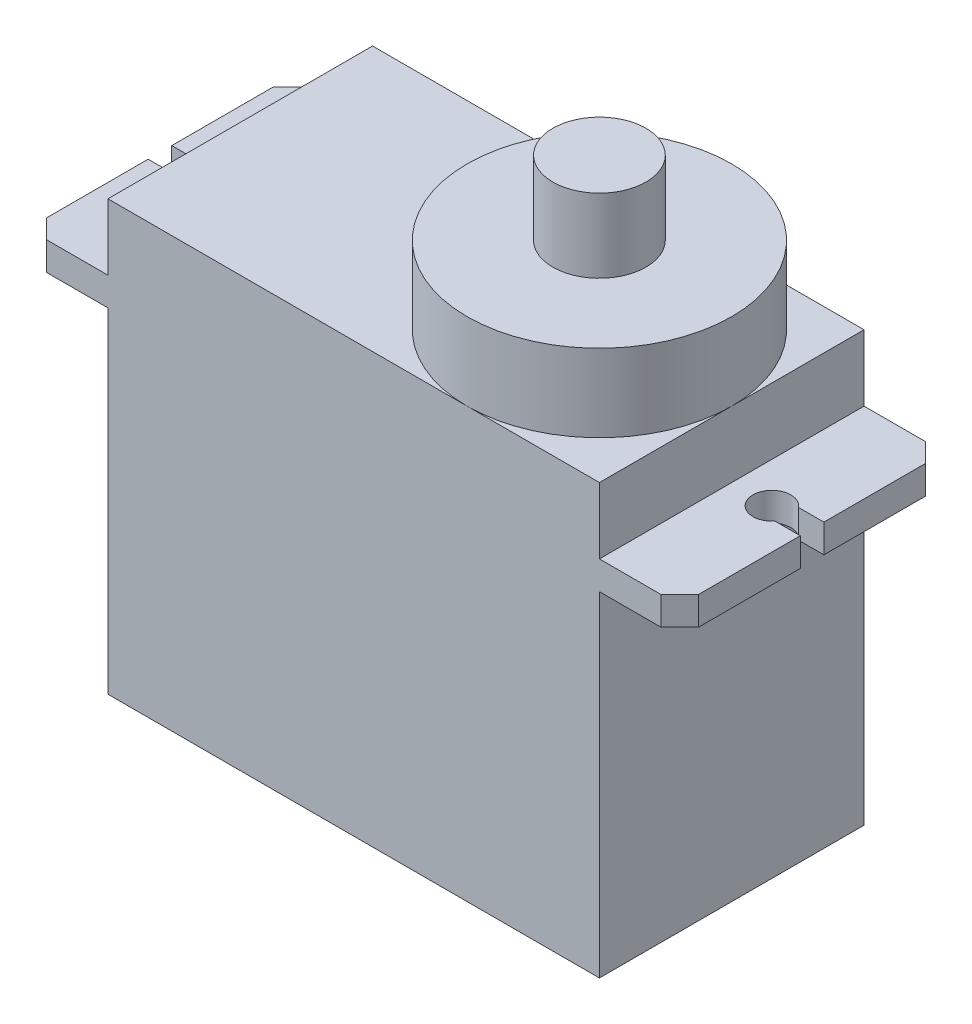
SolidWorks part; units mm, degrees
ref_plane "Front Plane" through (0, 0, 0) normal (0, 0, 1) x (1, 0, 0)
ref_plane "Top Plane" through (0, 0, 0) normal (0, 1, 0) x (1, 0, 0)
ref_plane "Right Plane" through (0, 0, 0) normal (1, 0, 0) x (0, 0, -1)
sketch "Sketch1" plane through (0, 0, 0) normal (0, 1, 0) x (1, 0, 0)
  line L1 (0, 0) -> (26, 0)
  line L2 (0, 0) -> (0, 14)
  line L3 (0, 14) -> (26, 14)
  line L4 (26, 0) -> (26, 14)
  dimension "D1" = 14
  dimension "D2" = 26
extrude "Boss-Extrude1" add sketch "Sketch1" along normal blind 22.7
ref_plane "Plane1" through (0, 19.2, 0) normal (0, 1, 0) x (1, 0, 0)
sketch "Sketch2" plane through (0, 19.2, 0) normal (0, 1, 0) x (1, 0, 0)
  line L0 (26, 14) -> (0, 14) construction
  line L1 (-4.25, 14) -> (30.25, 14)
  line L2 (-4.25, 14) -> (-4.25, 0)
  line L3 (-4.25, 0) -> (30.25, 0)
  line L4 (30.25, 14) -> (30.25, 0)
  line L5 (0, 0) -> (26, 0) construction
  point P9 (13, 14)
  point P10 (13, 14)
  dimension "D1" = 34.5
extrude "Boss-Extrude2" add sketch "Sketch2" against normal blind 1.5
chamfer "Chamfer1" distance 1 angle 45 4 edges at (-4.25, 18.45, -14) (-4.25, 18.45, 0) (30.25, 18.45, -14) (30.25, 18.45, 0)
sketch "Sketch3" plane through (0, 0, 0) normal (0, -1, 0) x (1, 0, 0)
  line L0 (0, 0) -> (26, 0) construction
  line L1 (26, 0) -> (26, -14) construction
  line L2 (26, -14) -> (0, -14) construction
  circle A0 centre (19, -7) radius 7
extrude "Boss-Extrude3" add sketch "Sketch3" against normal blind 26.8
sketch "Sketch4" plane through (0, 26.8, 0) normal (0, 1, 0) x (1, 0, 0)
  circle A0 centre (19, 7) radius 2.465
  circle A1 centre (19, 7) radius 7 construction
  dimension "D1" = 4.93
extrude "Boss-Extrude4" add sketch "Sketch4" along normal blind 3.9
sketch "Sketch5" plane through (0, 19.2, 0) normal (0, 1, 0) x (1, 0, 0)
  line L0 (30.25, 1) -> (30.25, 13) construction
  line L1 (-4.25, 13) -> (-4.25, 1) construction
  circle A0 centre (28.125, 7) radius 1
  circle A1 centre (-2.125, 7) radius 1
  point P9 (30.25, 7)
  dimension "D1" = 2
  dimension "D2" = 2.125
  dimension "D3" = 2.125
extrude "Cut-Extrude1" cut sketch "Sketch5" against normal through all
sketch "Sketch7" plane through (0, 19.2, 0) normal (0, 1, 0) x (1, 0, 0)
  line L1 (28.0231, 6.375) -> (32.8405, 6.375)
  line L2 (28.0231, 6.375) -> (28.0231, 7.625)
  line L3 (28.0231, 7.625) -> (32.8405, 7.625)
  line L4 (32.8405, 6.375) -> (32.8405, 7.625)
  line L5 (28.0231, 6.375) -> (32.8405, 7.625) construction
  line L6 (28.0231, 7.625) -> (32.8405, 6.375) construction
  line L7 (-12.5678, 7.625) -> (-2.0231, 7.625)
  line L8 (-12.5678, 7.625) -> (-12.5678, 6.375)
  line L9 (-12.5678, 6.375) -> (-2.0231, 6.375)
  line L10 (-2.0231, 7.625) -> (-2.0231, 6.375)
  line L11 (-12.5678, 7.625) -> (-2.0231, 6.375) construction
  line L12 (-12.5678, 6.375) -> (-2.0231, 7.625) construction
  circle A1 centre (-2.125, 7) radius 1 construction
  point P0 (30.4318, 7)
  point P5 (-7.2955, 7)
  dimension "D1" = 1.25
  dimension "D2" = 1.25
extrude "Cut-Extrude2" cut sketch "Sketch7" against normal through all
